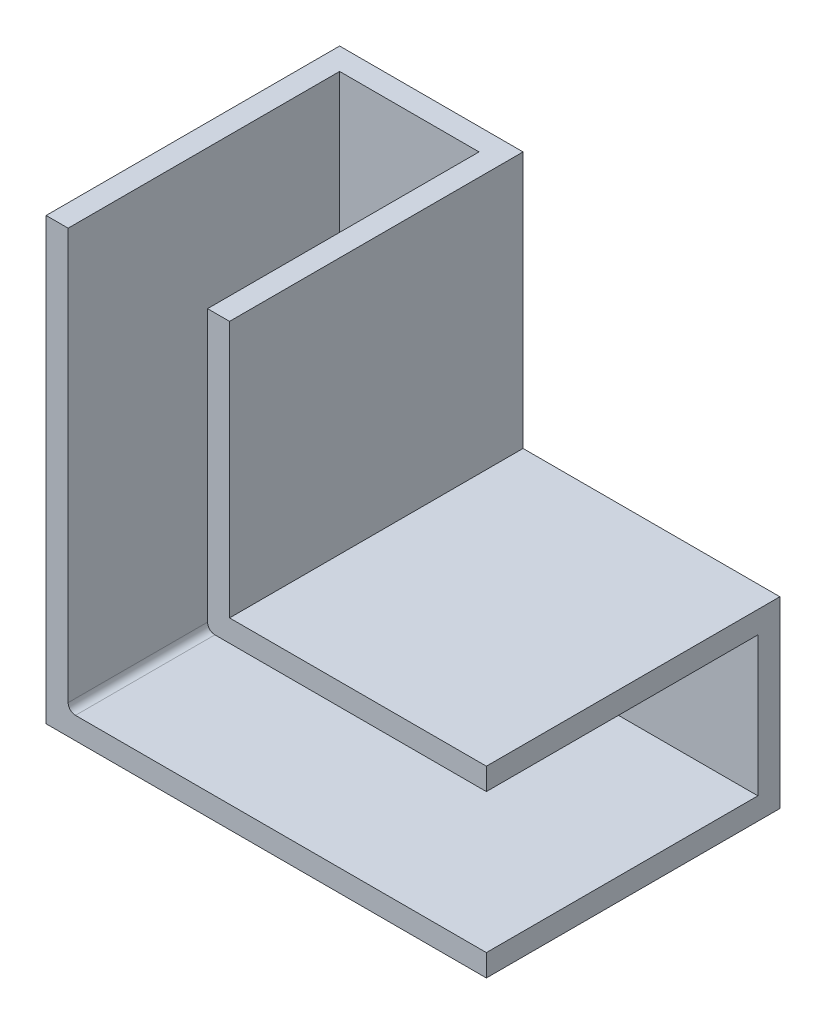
SolidWorks part; units mm, degrees
ref_plane "Front Plane" through (0, 0, 0) normal (0, 0, 1) x (1, 0, 0)
ref_plane "Top Plane" through (0, 0, 0) normal (0, 1, 0) x (1, 0, 0)
ref_plane "Right Plane" through (0, 0, 0) normal (1, 0, 0) x (0, 0, -1)
sketch "Sketch1" plane through (0, 0, 0) normal (0, 0, 1) x (1, 0, 0)
  line L1 (-50.5714, 22.6429) -> (-25.5714, 22.6429)
  line L2 (-50.5714, 22.6429) -> (-50.5714, -37.3571)
  line L4 (-25.5714, 22.6429) -> (-25.5714, -12.3571)
  line L5 (-25.5714, -12.3571) -> (9.4286, -12.3571)
  line L7 (-50.5714, -37.3571) -> (9.4286, -37.3571)
  line L8 (9.4286, -12.3571) -> (9.4286, -37.3571)
  dimension "D1" = 60
  dimension "D2" = 60
  dimension "D3" = 25
extrude "Boss-Extrude1" add sketch "Sketch1" along normal blind 40
shell "Shell3" thickness 3
fillet "Fillet1" radius 1 2 edges at (-47.5714, -34.3571, 21.5) (-28.5714, -15.3571, 21.5)
